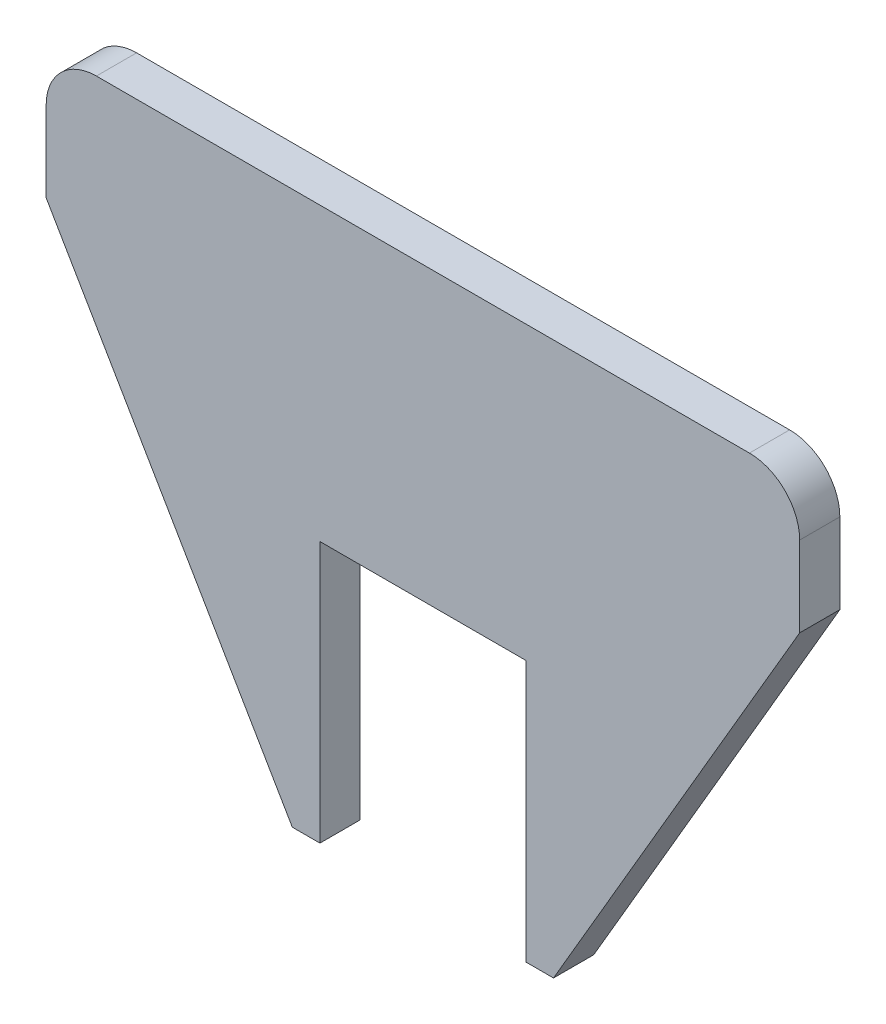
SolidWorks part; units mm, degrees
ref_plane "Plan de face" through (0, 0, 0) normal (0, 0, 1) x (1, 0, 0)
ref_plane "Plan de dessus" through (0, 0, 0) normal (0, 1, 0) x (1, 0, 0)
ref_plane "Plan de droite" through (0, 0, 0) normal (1, 0, 0) x (0, 0, -1)
sketch "Esquisse1" plane through (0, 0, 0) normal (0, 0, 1) x (1, 0, 0)
  line L0 (23.25, 0) -> (20.5, 0)
  line L1 (42.75, 55) -> (-22.25, 55)
  line L2 (0, 26) -> (0, 0)
  line L3 (20.5, 26) -> (20.5, 0)
  line L4 (-27.25, 42) -> (-2.75, 0)
  line L7 (0, 0) -> (-2.75, 0)
  line L9 (-27.25, 50) -> (-27.25, 42)
  line L14 (20.5, 26) -> (0, 26)
  line L15 (47.75, 42) -> (23.25, 0)
  line L19 (47.75, 50) -> (47.75, 42)
  arc A0 (-22.25, 55) -> (-27.25, 50) centre (-22.25, 50) ccw
  arc A1 (47.75, 50) -> (42.75, 55) centre (42.75, 50) ccw
extrude "Extrusion1" add sketch "Esquisse1" along normal blind 4
